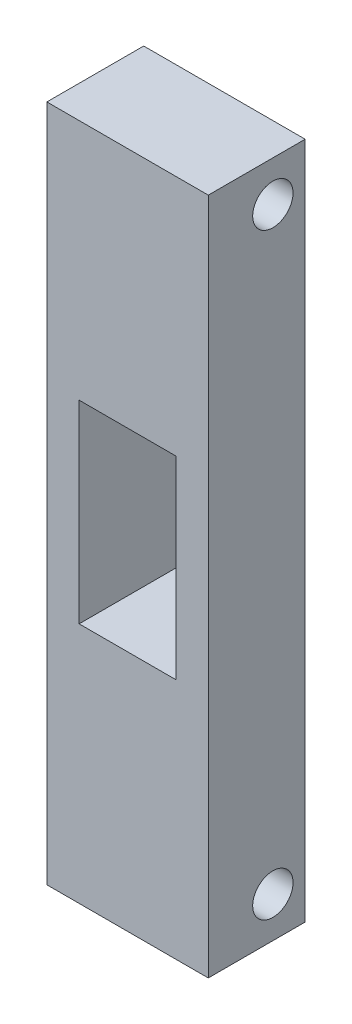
SolidWorks part; units mm, degrees
ref_plane "Спереди" through (0, 0, 0) normal (0, 0, 1) x (1, 0, 0)
ref_plane "Сверху" through (0, 0, 0) normal (0, 1, 0) x (1, 0, 0)
ref_plane "Справа" through (0, 0, 0) normal (1, 0, 0) x (0, 0, -1)
other "Configuration Table"
sketch "Эскиз1" plane through (0, 0, 0) normal (0, 0, 1) x (1, 0, 0)
  line L1 (-5, 21) -> (5, 21)
  line L2 (-5, 21) -> (-5, -21)
  line L3 (-5, -21) -> (5, -21)
  line L4 (5, 21) -> (5, -21)
  line L5 (-5, 21) -> (5, -21) construction
  line L6 (-5, -21) -> (5, 21) construction
  line L7 (-3, 6) -> (3, 6)
  line L8 (-3, 6) -> (-3, -6)
  line L9 (-3, -6) -> (3, -6)
  line L10 (3, 6) -> (3, -6)
  line L11 (-3, 6) -> (3, -6) construction
  line L12 (-3, -6) -> (3, 6) construction
  point P0 (0, 0)
  point P6 (0, 0)
  dimension "D1" = 42
  dimension "D2" = 10
  dimension "D3" = 15
  dimension "D4" = 6
extrude "Бобышка-Вытянуть1" add sketch "Эскиз1" along normal blind 6
sketch "Эскиз2" plane through (5, 0, 0) normal (1, 0, 0) x (0, 0, -1)
  line L0 (-2, 21) -> (-2, -21) construction
  line L1 (-6, 21) -> (0, 21) construction
  line L2 (-6, -21) -> (0, -21) construction
  line L3 (-6, 18.5) -> (0, 18.5) construction
  line L4 (-6, -21) -> (-6, 21) construction
  line L5 (0, -21) -> (0, 21) construction
  line L6 (-6, -18.5) -> (0, -18.5) construction
  circle A0 centre (-2, 18.5) radius 1.25
  circle A1 centre (-2, -18.5) radius 1.25
  dimension "D3" = 2.5
  dimension "D4" = 2.5
  dimension "D1" = 37
  dimension "D2" = 2.5
  dimension "D5" = 2
extrude "Вырез-Вытянуть1" cut sketch "Эскиз2" against normal blind 12
